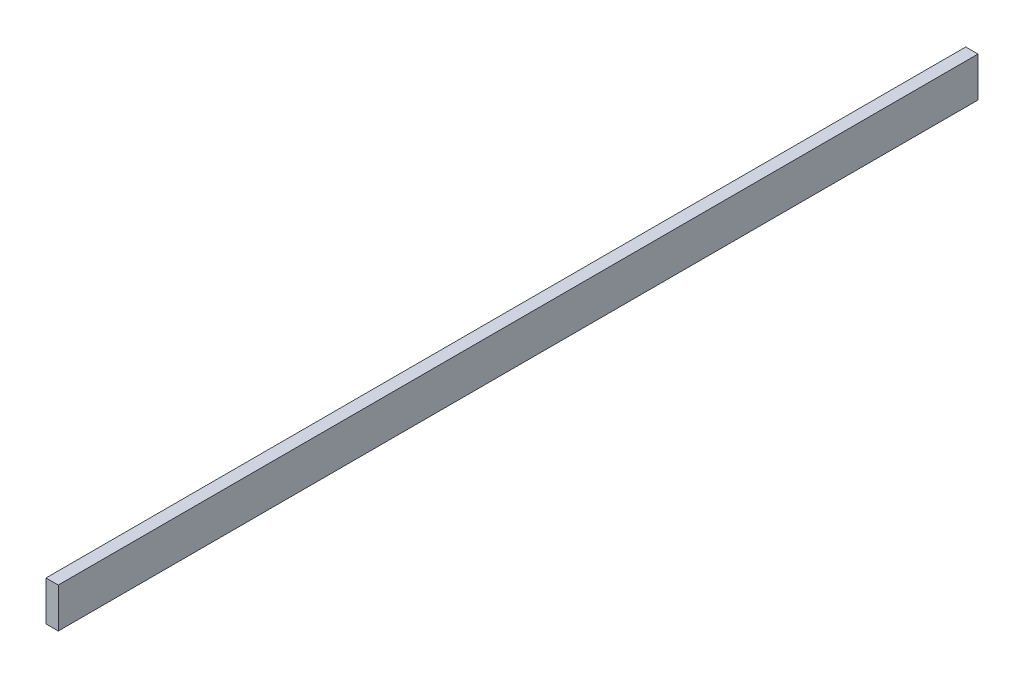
SolidWorks part; units mm, degrees
ref_plane "Plan de face" through (0, 0, 0) normal (0, 0, 1) x (1, 0, 0)
ref_plane "Plan de dessus" through (0, 0, 0) normal (0, 1, 0) x (1, 0, 0)
ref_plane "Plan de droite" through (0, 0, 0) normal (1, 0, 0) x (0, 0, -1)
sketch "Esquisse1" plane through (0, 0, 0) normal (0, 0, 1) x (1, 0, 0)
  line L1 (-2, 6.5) -> (2, 6.5)
  line L2 (-2, 6.5) -> (-2, -6.5)
  line L3 (-2, -6.5) -> (2, -6.5)
  line L4 (2, 6.5) -> (2, -6.5)
  point P4 (0, 6.5)
  point P5 (-2, 0)
  dimension "D1" = 4
  dimension "D2" = 13
extrude "Extrusion1" add sketch "Esquisse1" along normal mid plane 300
